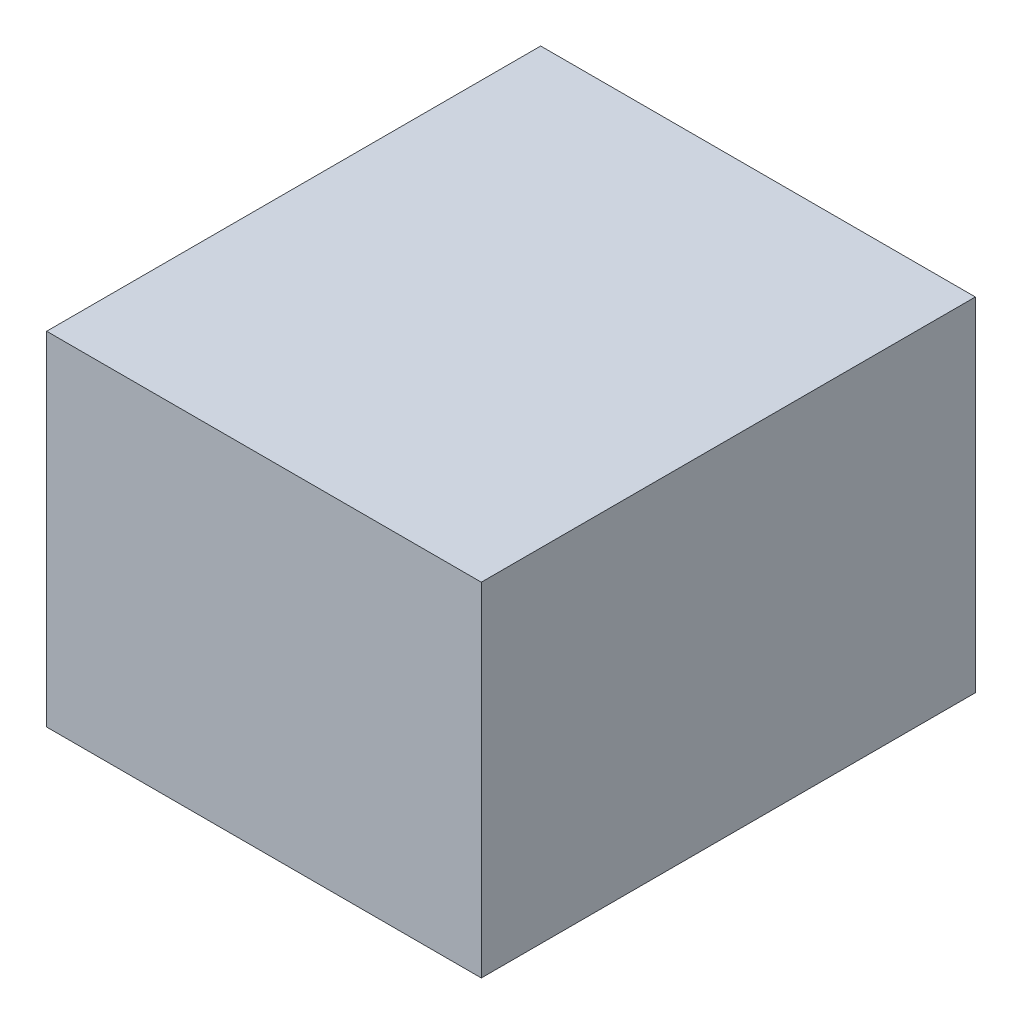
SolidWorks part; units mm, degrees
ref_plane "Front Plane" through (0, 0, 0) normal (0, 0, 1) x (1, 0, 0)
ref_plane "Top Plane" through (0, 0, 0) normal (0, 1, 0) x (1, 0, 0)
ref_plane "Right Plane" through (0, 0, 0) normal (1, 0, 0) x (0, 0, -1)
body saved out of another part "Stock-Multibody - save bodies-1"
